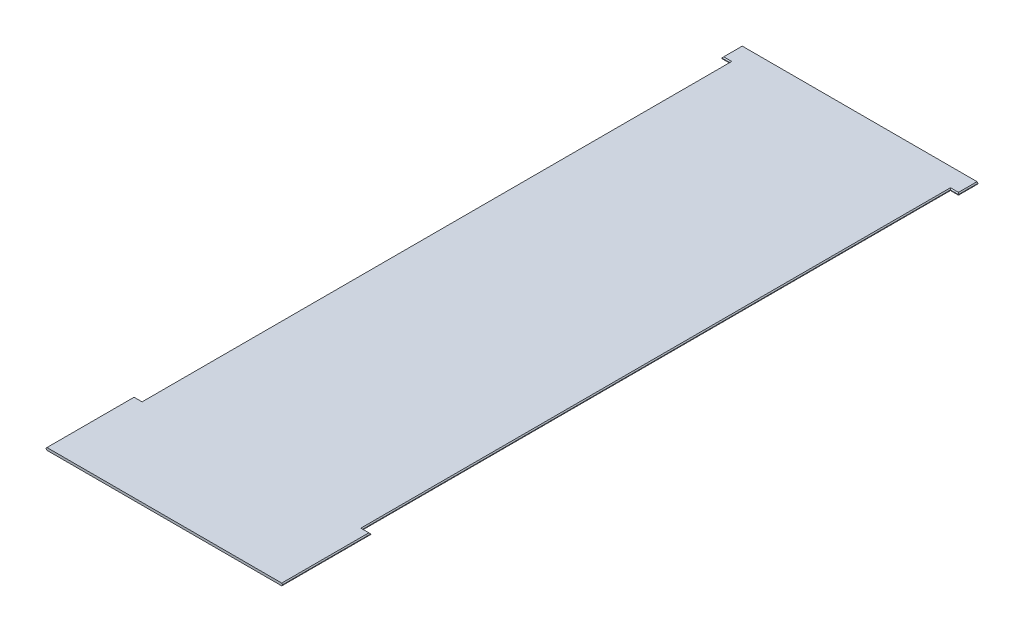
SolidWorks part; units mm, degrees
ref_plane "Front Plane" through (0, 0, 0) normal (1, 0, 0) x (0, 1, 0)
ref_plane "Top Plane" through (0, 0, 0) normal (0, 0, 1) x (0, 1, 0)
ref_plane "Right Plane" through (0, 0, 0) normal (0, 1, 0) x (-1, 0, 0)
sketch "Sketch2"
sketch_block_instance "Block5-1"
sketch_block "Block5" parameters "D1"=79.2, "D2"=79.2
extrude "Boss-Extrude2" add sketch "Sketch2" along normal mid plane 12.7
chamfer "Chamfer1" distance 5 angle 45 32 edges at (512.1616, 0, -1445.0719) (532.7116, 6.35, -1445.0719) (532.7116, -6.35, -1445.0719) (553.2616, 0, -1445.0719) (553.2616, 6.35, -1495.0719) (553.2616, 0, -1545.0719) (553.2616, -6.35, -1495.0719) (512.1616, 6.35, 60.9281) (512.1616, -6.35, 60.9281) (532.7116, 6.35, 1566.9281) (512.1616, 0, 1566.9281) (532.7116, -6.35, 1566.9281) (553.2616, 0, 2018.1281) (553.2616, 6.35, 1792.5281) (553.2616, 0, 1566.9281) (553.2616, -6.35, 1792.5281) (-659.9384, 0, 1566.9281) (-659.9384, 6.35, 1792.5281) (-659.9384, 0, 2018.1281) (-659.9384, -6.35, 1792.5281) (-639.3884, 6.35, 1566.9281) (-639.3884, -6.35, 1566.9281) (-618.8384, 6.35, 60.9281) (-618.8384, 0, 1566.9281) (-618.8384, -6.35, 60.9281) (-639.3884, 6.35, -1445.0719) (-618.8384, 0, -1445.0719) (-639.3884, -6.35, -1445.0719) (-659.9384, 0, -1545.0719) (-659.9384, 6.35, -1495.0719) (-659.9384, 0, -1445.0719) (-659.9384, -6.35, -1495.0719)
